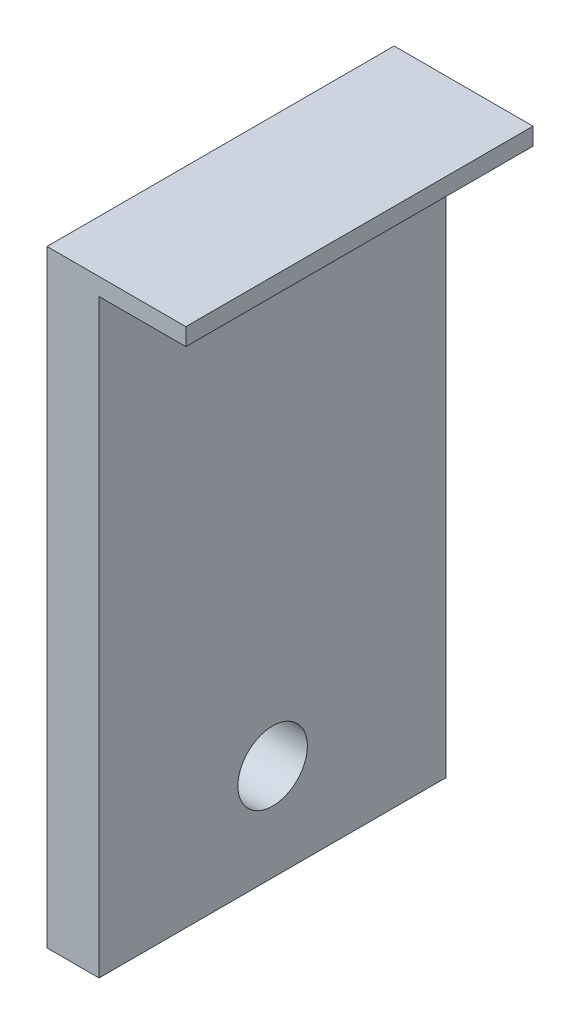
SolidWorks part; units mm, degrees
ref_plane "Front Plane" through (0, 0, 0) normal (0, 0, 1) x (1, 0, 0)
ref_plane "Top Plane" through (0, 0, 0) normal (0, 1, 0) x (1, 0, 0)
ref_plane "Right Plane" through (0, 0, 0) normal (1, 0, 0) x (0, 0, -1)
sketch "Sketch1" plane through (0, 0, 0) normal (0, 1, 0) x (1, 0, 0)
  line L1 (0, 0) -> (3, 0)
  line L2 (0, 0) -> (0, 20)
  line L3 (0, 20) -> (3, 20)
  line L4 (3, 0) -> (3, 20)
  dimension "D1" = 3
  dimension "D2" = 20
extrude "Boss-Extrude1" add sketch "Sketch1" along normal blind 35
sketch "Sketch2" plane through (3, 0, 0) normal (1, 0, 0) x (0, 0, -1)
  line L0 (20, 35) -> (20, 0) construction
  line L1 (0, 35) -> (20, 35)
  line L2 (0, 35) -> (0, 34)
  line L3 (0, 34) -> (20, 34)
  line L4 (20, 35) -> (20, 34)
  dimension "D1" = 1
extrude "Boss-Extrude2" add sketch "Sketch2" along normal blind 5
sketch "Sketch3" plane through (0, 0, 0) normal (-1, 0, 0) x (0, 0, 1)
  line L0 (-10, 0) -> (-10, 35) construction
  line L1 (-20, 0) -> (0, 0) construction
  line L2 (-20, 35) -> (0, 35) construction
  line L3 (-20, 17.5) -> (0, 17.5) construction
  line L4 (-20, 35) -> (-20, 0) construction
  line L5 (0, 35) -> (0, 0) construction
  circle A1 centre (-10, 5.5799) radius 2
extrude "Cut-Extrude1" cut sketch "Sketch3" against normal blind 5
